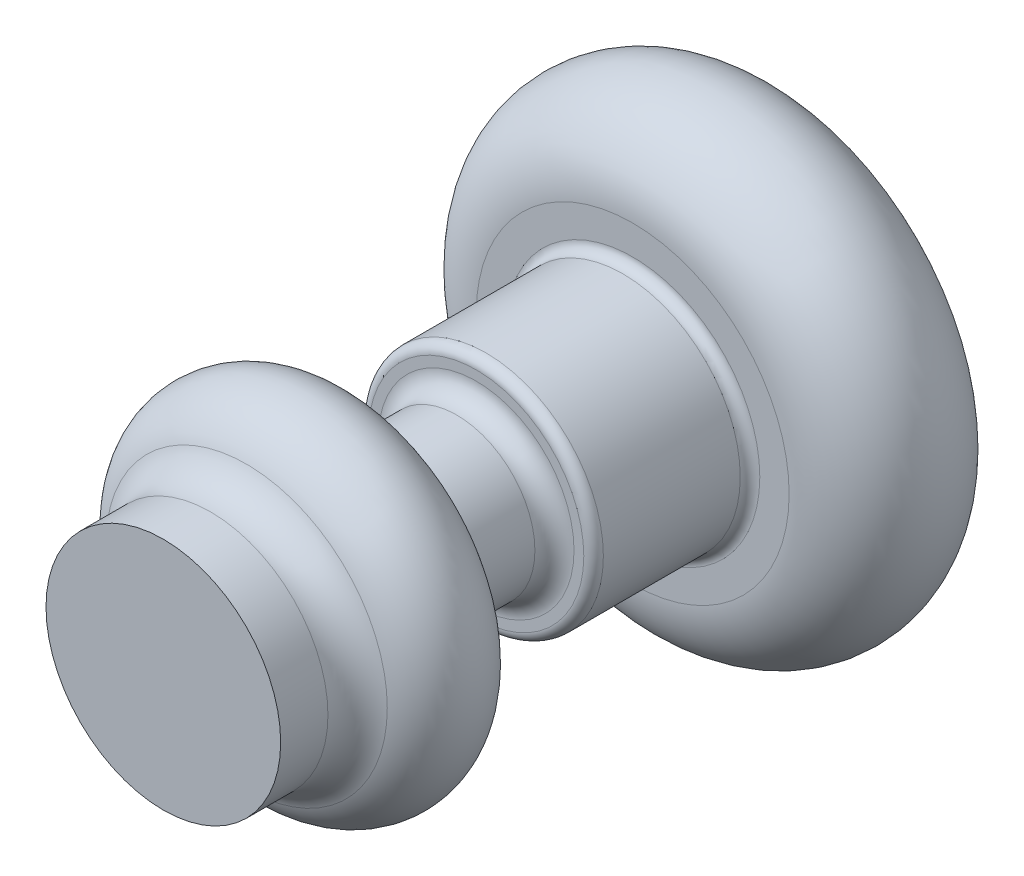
SolidWorks part; units mm, degrees
ref_plane "Front Plane" through (0, 0, 0) normal (0, 0, 1) x (1, 0, 0)
ref_plane "Top Plane" through (0, 0, 0) normal (0, 1, 0) x (1, 0, 0)
ref_plane "Right Plane" through (0, 0, 0) normal (1, 0, 0) x (0, 0, -1)
sketch "Sketch1" plane through (0, 0, 0) normal (0, 1, 0) x (1, 0, 0)
  line L0 (-28.05, 0) -> (-25.5, 0)
  line L1 (-20.4, -5.1) -> (-20.4, -20.4)
  line L2 (-30.6, -69.2711) -> (-30.6, -81.6)
  line L3 (-30.6, -81.6) -> (30.6, -81.6)
  line L4 (30.6, -81.6) -> (30.6, -69.2711)
  line L5 (20.4, -20.4) -> (20.4, -5.1)
  line L6 (25.5, 0) -> (28.05, 0)
  line L7 (33.15, 40.8) -> (40.8, 40.8)
  line L8 (40.8, 81.6) -> (-40.8, 81.6)
  line L9 (-40.8, 40.8) -> (-33.15, 40.8)
  line L10 (-30.6, 2.55) -> (-30.6, 38.25)
  line L11 (30.6, 2.55) -> (30.6, 38.25)
  line L12 (0, -81.6) -> (0, 81.6) construction
  arc A0 (-30.6, 2.55) -> (-28.05, 0) centre (-28.05, 2.55) ccw
  arc A1 (-20.4, -5.1) -> (-25.5, 0) centre (-25.5, -5.1) ccw
  arc A2 (-30.6, -30.6) -> (-20.4, -20.4) centre (-30.6, -20.4) ccw
  arc A3 (-30.6, -30.6) -> (-36.72, -59.9227) centre (-30.6, -45.9) ccw
  arc A4 (-30.6, -69.2711) -> (-36.72, -59.9227) centre (-40.8, -69.2711) ccw
  arc A5 (36.72, -59.9227) -> (30.6, -69.2711) centre (40.8, -69.2711) ccw
  arc A6 (36.72, -59.9227) -> (30.6, -30.6) centre (30.6, -45.9) ccw
  arc A7 (20.4, -20.4) -> (30.6, -30.6) centre (30.6, -20.4) ccw
  arc A8 (25.5, 0) -> (20.4, -5.1) centre (25.5, -5.1) ccw
  arc A9 (28.05, 0) -> (30.6, 2.55) centre (28.05, 2.55) ccw
  arc A10 (33.15, 40.8) -> (30.6, 38.25) centre (33.15, 38.25) ccw
  arc A11 (40.8, 40.8) -> (40.8, 81.6) centre (40.8, 61.2) ccw
  arc A12 (-40.8, 81.6) -> (-40.8, 40.8) centre (-40.8, 61.2) ccw
  arc A13 (-30.6, 38.25) -> (-33.15, 40.8) centre (-33.15, 38.25) ccw
revolve "Revolve1" add sketch "Sketch1" angle 360 about L12
